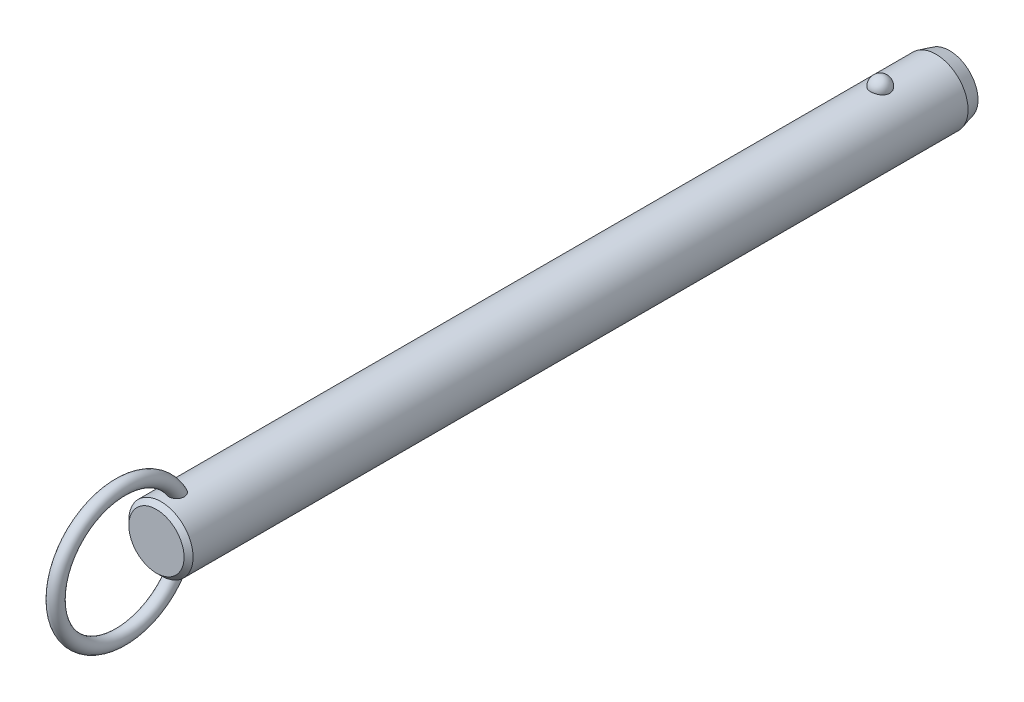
SolidWorks part; units mm, degrees
ref_plane "Front Plane" through (0, 0, 0) normal (0, 0, 1) x (1, 0, 0)
ref_plane "Top Plane" through (0, 0, 0) normal (0, 1, 0) x (1, 0, 0)
ref_plane "Right Plane" through (0, 0, 0) normal (1, 0, 0) x (0, 0, -1)
sketch "Sketch2" plane through (0, 0, 0) normal (0, 0, 1) x (1, 0, 0)
  circle A0 centre (0, 0) radius 7.1
  point P3 (0, 7.1)
  dimension "D1" = 14.2
extrude "Boss-Extrude1" add sketch "Sketch2" along normal blind 149.9
sketch "Sketch3" plane through (0, 0, 0) normal (0, 0, -1) x (-1, 0, 0)
  circle A0 centre (0, 0) radius 7.1
  dimension "D1" = 14.2
extrude "Boss-Extrude2" add sketch "Sketch3" along normal blind 17.4
chamfer "Chamfer1" distance 3 angle 15 1 edges at (-7.1, 0, -17.4)
sketch "Sketch12" plane through (0, 0, 0) normal (1, 0, 0) x (0, 0, -1)
  line L0 (-149.9, 7.1) -> (-149.9, -7.1) construction
  point P0 (-149.9, 0)
sketch "Sketch13" plane through (0, 0, 0) normal (1, 0, 0) x (0, 0, -1)
  circle A0 centre (-165.75, 0) radius 15.85
  point P2 (-149.9, 0)
  dimension "D1" = 31.7
sketch "Sketch14" plane through (0, 0, 0) normal (0, 1, 0) x (1, 0, 0)
  circle A0 centre (0, -151.4) radius 1.5
  point P2 (0, -149.9)
  dimension "D1" = 3
sweep "Sweep1" add profiles "Sketch14" path "Sketch13"
sketch "Sketch15" plane through (0, 0, 149.9) normal (0, 0, 1) x (1, 0, 0)
  circle A0 centre (0, 0) radius 7.1
  dimension "D1" = 14.2
extrude "Boss-Extrude3" add sketch "Sketch15" along normal blind 7.92
chamfer "Chamfer2" distance 1 angle 45 1 edges at (7.1, 0, 157.82)
sketch "Sketch18" plane through (0, 0, 0) normal (1, 0, 0) x (0, 0, -1)
  line L0 (14.4, 7.1) -> (-151.5792, 7.1) construction
  line L1 (2.1, 9.2) -> (2.1, 5)
  line L2 (-151.5792, -7.1) -> (14.4, -7.1) construction
  arc A0 (2.1, 9.2) -> (2.1, 5) centre (2.1, 7.1) ccw
  point P4 (0, 7.1)
  dimension "D1" = 16.3
revolve "Revolve1" add sketch "Sketch18" angle 360 about L1
